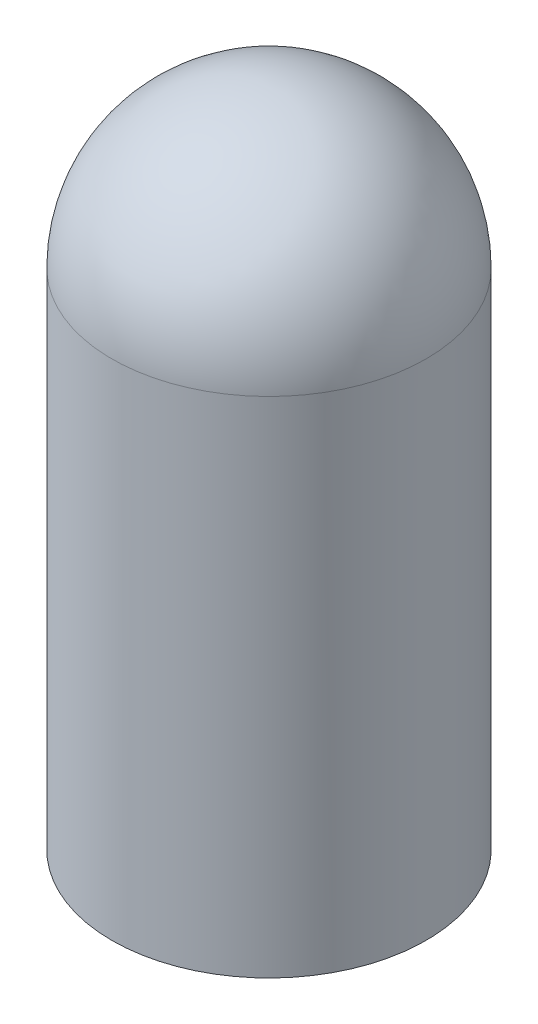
SolidWorks part; units mm, degrees
ref_plane "Front Plane" through (0, 0, 0) normal (0, 0, 1) x (1, 0, 0)
ref_plane "Top Plane" through (0, 0, 0) normal (0, 1, 0) x (1, 0, 0)
ref_plane "Right Plane" through (0, 0, 0) normal (1, 0, 0) x (0, 0, -1)
sketch "Sketch1" plane through (0, 0, 0) normal (0, 0, 1) x (1, 0, 0)
  line L0 (0, 0) -> (0, 50000) construction
  line L1 (-9.75, 0) -> (-9.75, 31.2843)
  line L4 (0, 0) -> (50000, 0) construction
  line L7 (-9.25, 0) -> (-9.25, 31.25)
  line L10 (-9.75, 0) -> (-9.25, 0)
  line L11 (-9.75, 31.2843) -> (-9.25, 31.25)
  line L12 (0, 41) -> (0, 40.5)
  arc A1 (0, 41) -> (-9.75, 31.25) centre (0, 31.25) ccw
  arc A5 (0, 40.5) -> (-9.25, 31.25) centre (0, 31.25) ccw
  point P2 (0, 0)
  point P8 (0, 15.625)
  dimension "D1" = 18.5
  dimension "D2" = 19.5
revolve "Revolve1" add sketch "Sketch1" angle 360 about L0
